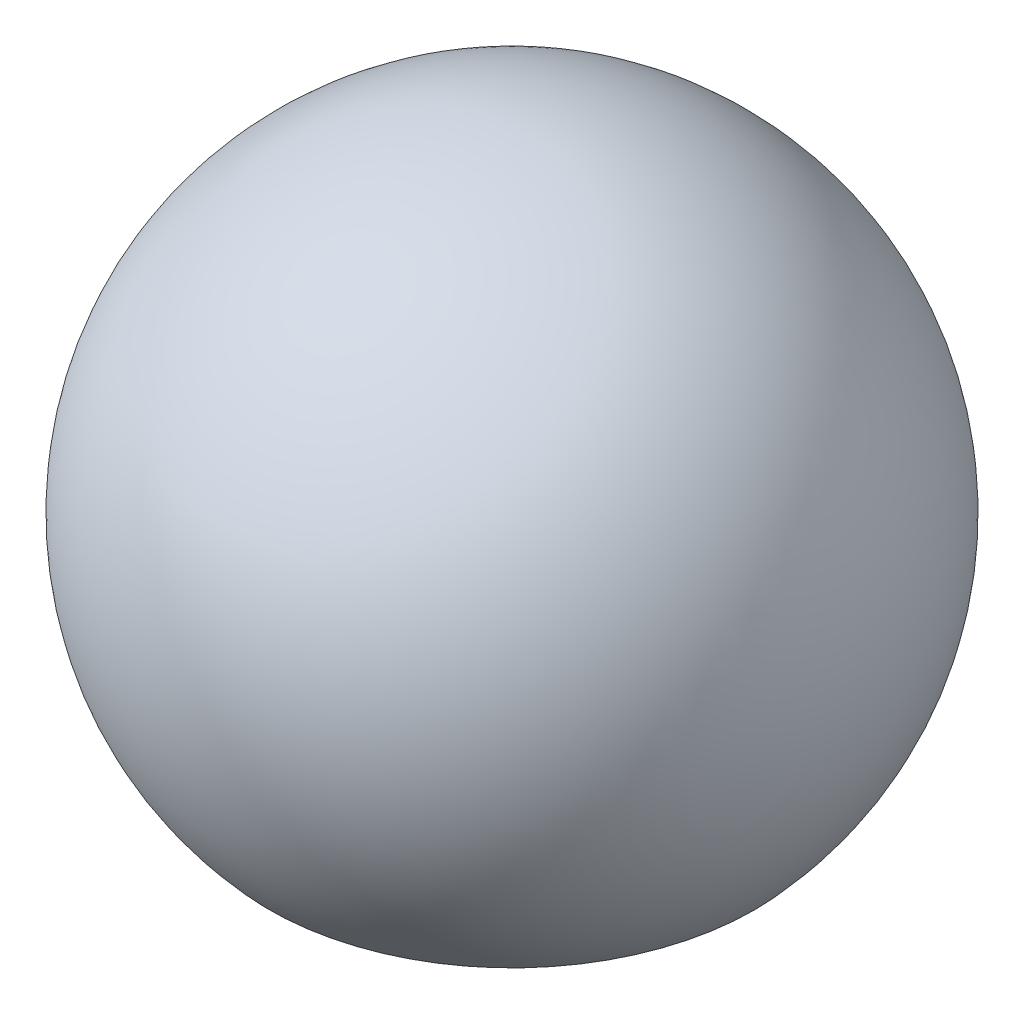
SolidWorks part; units mm, degrees
ref_plane "Front Plane" through (0, 0, 0) normal (0, 0, 1) x (1, 0, 0)
ref_plane "Top Plane" through (0, 0, 0) normal (0, 1, 0) x (1, 0, 0)
ref_plane "Right Plane" through (0, 0, 0) normal (1, 0, 0) x (0, 0, -1)
sketch "Sketch klot" plane through (0, 0, 0) normal (0, 0, 1) x (1, 0, 0)
  line L0 (0, 0) -> (0, 20) construction
  line L1 (0, 10) -> (2.5, 10) construction
  line L2 (2.5, 10) -> (2.5, 5) construction
  line L3 (2.5, 5) -> (7.3606, 3.2309) construction
  arc A0 (0, 20) -> (0, 0) centre (0, 10) cw construction
  dimension "D1" = 20
  dimension "D2" = 2.5
  dimension "D3" = 5
  dimension "D4" = 70
sketch "Sketch2" plane through (0, 0, 0) normal (0, 0, 1) x (1, 0, 0)
  line L0 (0, 10) -> (2.5, 10) construction
  line L1 (2.5, 10) -> (2.5, 5) construction
  line L2 (2.5, 5) -> (7.3606, 3.2309) construction
  line L3 (0, 10) -> (2.5, 10)
  line L4 (2.5, 10) -> (2.5, 5)
  line L5 (2.5, 5) -> (7.3606, 3.2309)
  line L6 (0, 0) -> (0, 20) construction
  line L7 (0, 10) -> (0, 20)
  arc A0 (0, 0) -> (0, 20) centre (0, 10) ccw construction
  arc A1 (7.3606, 3.2309) -> (0, 20) centre (0, 10) ccw
revolve "Revolve1" add sketch "Sketch2" angle 360 about L6
